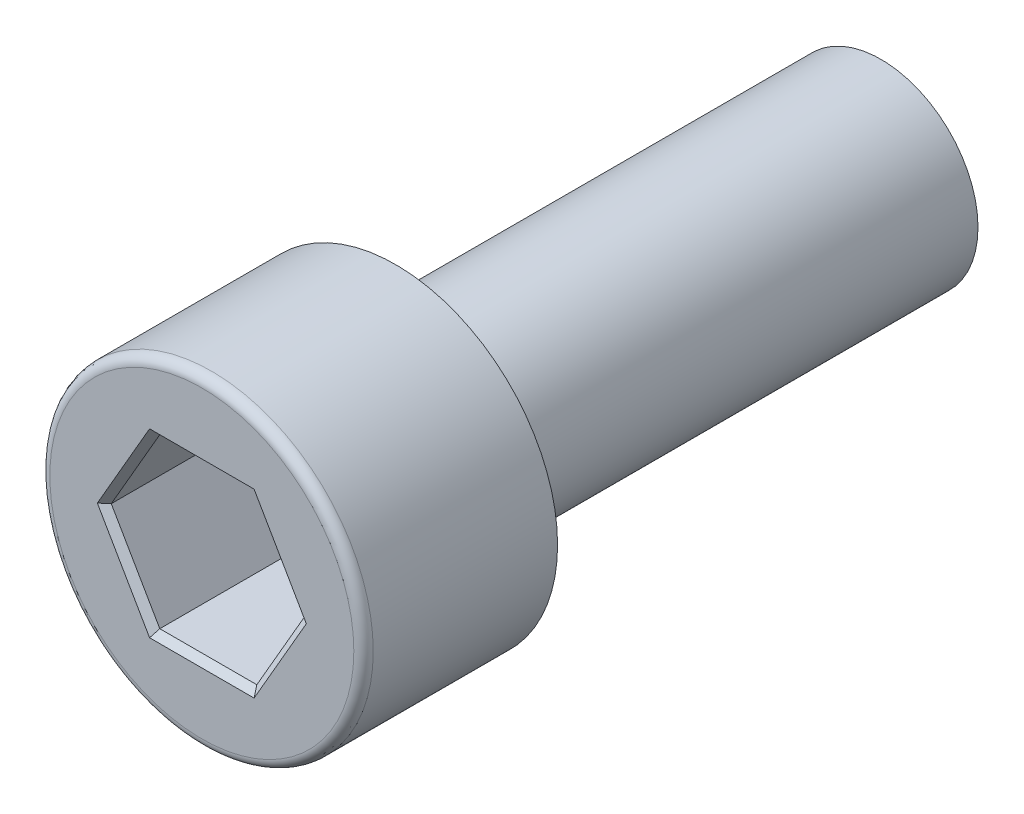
SolidWorks part; units mm, degrees
ref_plane "Plan1" through (0, 0, 0) normal (0, 0, 1) x (1, 0, 0)
ref_plane "Plan2" through (0, 0, 0) normal (0, 1, 0) x (1, 0, 0)
ref_plane "Plan3" through (0, 0, 0) normal (1, 0, 0) x (0, 0, -1)
sketch "Esquisse1" plane through (0, 0, 0) normal (0, 0, 1) x (1, 0, 0)
  circle A0 centre (0, 0) radius 3
extrude "Base-Extrusion" add sketch "Esquisse1" along normal blind 15
sketch "Esquisse2" plane through (0, 0, 15) normal (0, 0, 1) x (1, 0, 0)
  circle A0 centre (0, 0) radius 5
extrude "Boss.-Extru.1" add sketch "Esquisse2" along normal blind 6
sketch "Esquisse3" plane through (0, 0, 21) normal (0, 0, 1) x (1, 0, 0)
  line L0 (-3, 0) -> (-1.5001, 2.598)
  line L1 (-1.5001, 2.598) -> (1.5001, 2.598)
  line L2 (1.5001, 2.598) -> (3, 0)
  line L3 (3, 0) -> (1.5001, -2.598)
  line L4 (1.5001, -2.598) -> (-1.5001, -2.598)
  line L5 (-1.5001, -2.598) -> (-3, 0)
extrude "Enlèv. mat.-Extru.1" cut sketch "Esquisse3" against normal blind 4
chamfer "Chanfrein3" distance 0.2 angle 45
fillet "Congé1" radius 0.3
